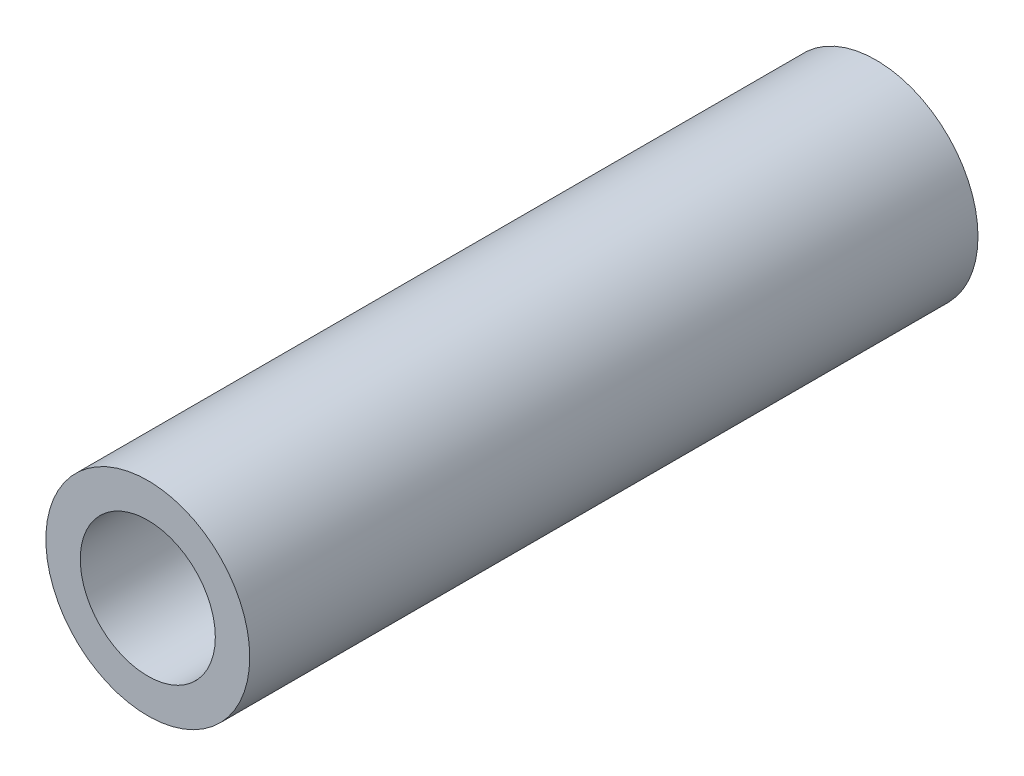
SolidWorks part; units mm, degrees
ref_plane "Front Plane" through (0, 0, 0) normal (0, 0, 1) x (1, 0, 0)
ref_plane "Top Plane" through (0, 0, 0) normal (0, 1, 0) x (1, 0, 0)
ref_plane "Right Plane" through (0, 0, 0) normal (1, 0, 0) x (0, 0, -1)
ref_plane "Plane1"
sketch "Sketch1" plane through (0, 0, 0) normal (0, 0, 1) x (1, 0, 0)
  circle A0 centre (0, 0) radius 4
  circle A1 centre (0, 0) radius 2.65
  dimension "D1" = 5.3
  dimension "D2" = 8
extrude "Extrusion1" add sketch "Sketch1" along normal blind 28.575 contours A0 A1
